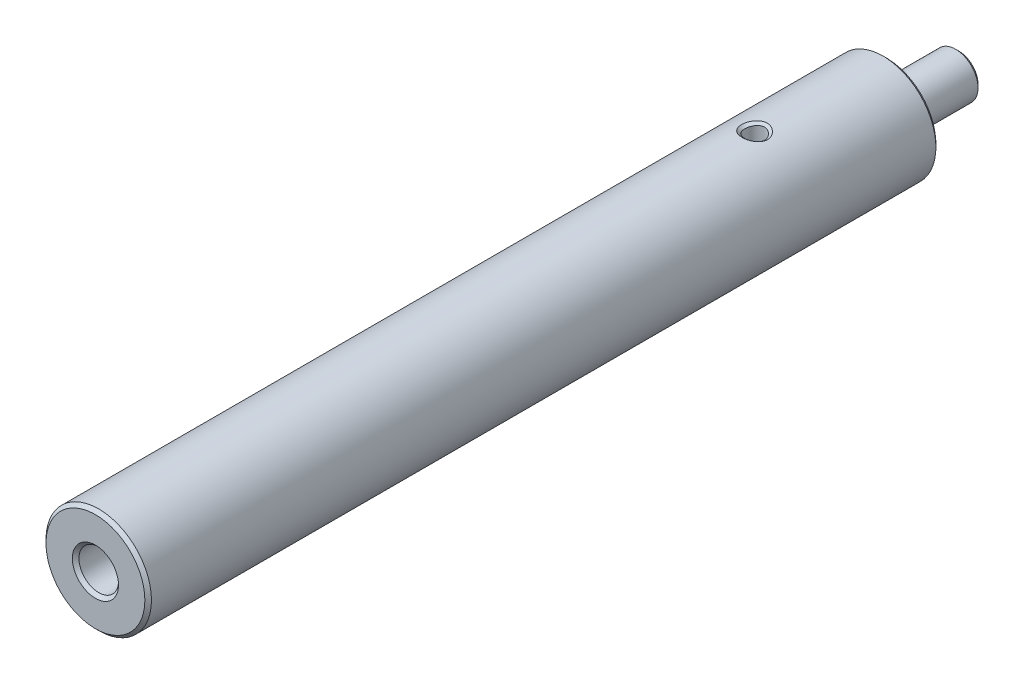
SolidWorks part; units mm, degrees
ref_plane "Спереди" through (0, 0, 0) normal (0, 0, 1) x (1, 0, 0)
ref_plane "Сверху" through (0, 0, 0) normal (0, 1, 0) x (1, 0, 0)
ref_plane "Справа" through (0, 0, 0) normal (1, 0, 0) x (0, 0, -1)
sketch "Эскиз1" plane through (0, 0, 0) normal (1, 0, 0) x (0, 0, -1)
  line L0 (0, 0) -> (0, 1.5)
  line L1 (0, 1.5) -> (-15, 1.5)
  line L2 (-15, 1.5) -> (-15, 4)
  line L3 (-15, 4) -> (45, 4)
  line L4 (45, 4) -> (45, 1.7)
  line L5 (45, 1.7) -> (50.5, 1.7)
  line L6 (50.5, 1.7) -> (50.5, 0)
  line L7 (50.5, 0) -> (0, 0)
  dimension "D1" = 15
  dimension "D2" = 1.5
  dimension "D3" = 4
  dimension "D4" = 5.5
  dimension "D5" = 60
  dimension "D6" = 1.7
revolve "Повернуть1" add sketch "Эскиз1" angle 360 about L7
sketch "Эскиз2" plane through (0, 0, 0) normal (0, 1, 0) x (1, 0, 0)
  line L0 (4, 45) -> (-4, 45) construction
  circle A0 centre (0, 35) radius 0.75
  dimension "D1" = 1.5
  dimension "D2" = 10
extrude "Вырез-Вытянуть1" cut sketch "Эскиз2" against normal mid plane 10
chamfer "Фаска1" distance 0.25 angle 45 7 edges at (-4, 0, -45) (-4, 0, 15) (0.1578, -3.9969, -35.7332) (-0.1578, 3.9969, -35.7332) (-1.5, 0, 15) (-1.5, 0, 0) (-1.7, 0, -50.5)
